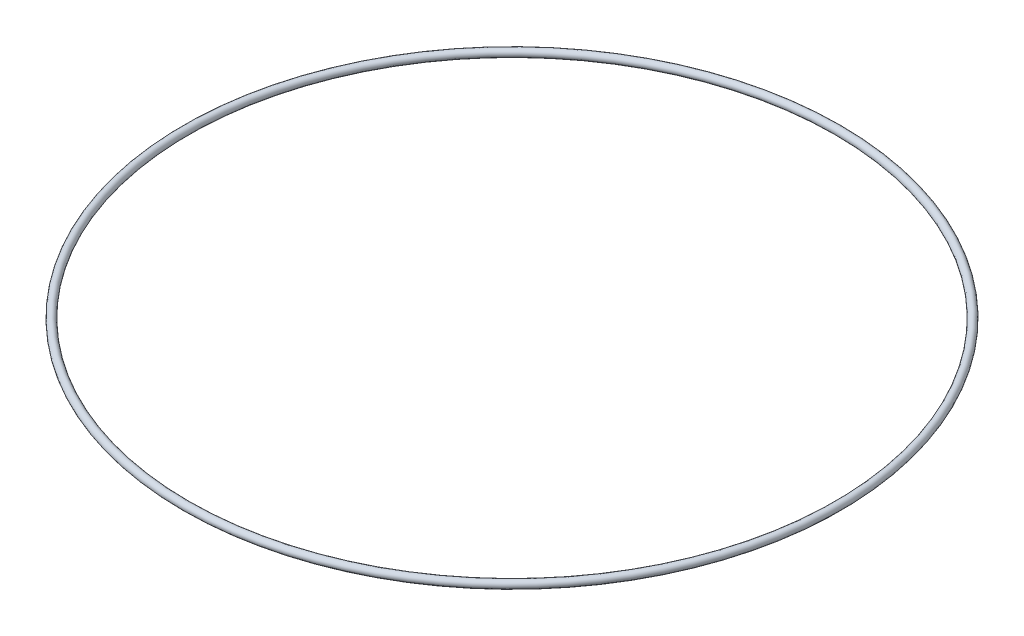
SolidWorks part; units mm, degrees
ref_plane "Plan1" through (0, 0, 0) normal (0, 0, 1) x (1, 0, 0)
ref_plane "Plan2" through (0, 0, 0) normal (0, 1, 0) x (1, 0, 0)
ref_plane "Plan3" through (0, 0, 0) normal (1, 0, 0) x (0, 0, -1)
sketch "Esquisse1" plane through (0, 0, 0) normal (0, 0, 1) x (1, 0, 0)
  line L1 (0, 0) -> (251.5, 0) construction
  line L2 (0, 1.5) -> (0, -1.5) construction
  circle A0 centre (127.25, 0) radius 1.5
  dimension "D2" = 127.25
  dimension "D1" = 3
  dimension "Diamètre du tore" = 3
  dimension "Diamètre intérieur" = 251.5
revolve "Base-Révolution" add sketch "Esquisse1" angle 360 about L2
equation " \"D1@Esquisse1\"=\"Diamètre du tore@Esquisse1\" "
equation "\"D2@Esquisse1\" = (\"Diamètre intérieur@Esquisse1\"/2)+(\"Diamètre du tore@Esquisse1\"/2)"
